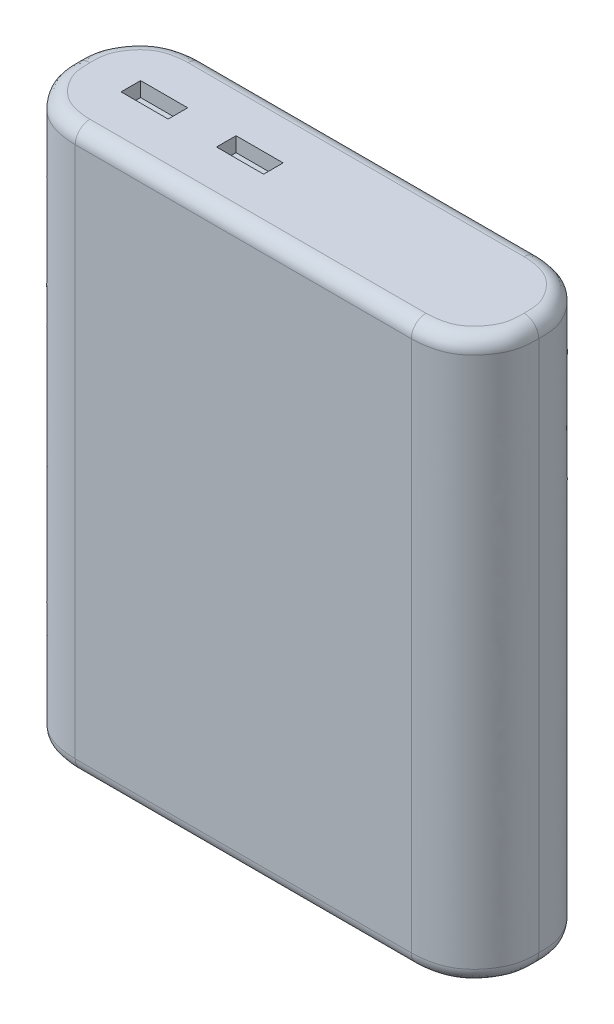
SolidWorks part; units mm, degrees
ref_plane "Front Plane" through (0, 0, 0) normal (0, 0, 1) x (1, 0, 0)
ref_plane "Top Plane" through (0, 0, 0) normal (0, 1, 0) x (1, 0, 0)
ref_plane "Right Plane" through (0, 0, 0) normal (1, 0, 0) x (0, 0, -1)
sketch "Sketch1" plane through (0, 0, 0) normal (0, 1, 0) x (1, 0, 0)
  line L0 (-29.0322, 0) -> (29.0322, 0)
  line L1 (29.0322, 0) -> (29.0322, -11.0109) construction
  line L2 (29.0322, -11.0109) -> (40.0431, -11.0109) construction
  line L3 (34.2155, -1.038) -> (34.2155, 0) construction
  line L4 (34.2155, 0) -> (29.0322, 0) construction
  line L5 (39.0051, -5.8276) -> (40.0431, -5.8276) construction
  line L6 (40.0431, -5.8276) -> (40.0431, -11.0109) construction
  line L7 (0, 0) -> (0, -10.5453) construction
  line L8 (-29.0322, -22.0218) -> (29.0322, -22.0218)
  spline S0 degree 3 poles (29.0322, 0) (30.334, 0) (35.1969, -0.5296) (39.334, -5.5865) (40.0431, -8.4922) (40.0431, -11.0109) knots 0 0 0 0 0.304751 0.695249 1 1 1 1
  spline S1 degree 3 poles (29.0322, -22.0218) (30.334, -22.0218) (35.1969, -21.4922) (39.334, -16.4353) (40.0431, -13.5296) (40.0431, -11.0109) knots 0 0 0 0 0.304751 0.695249 1 1 1 1
  spline S2 degree 3 poles (-29.0322, -22.0218) (-30.334, -22.0218) (-35.1969, -21.4922) (-39.334, -16.4353) (-40.0431, -13.5296) (-40.0431, -11.0109) knots 0 0 0 0 0.304751 0.695249 1 1 1 1
  spline S3 degree 3 poles (-29.0322, 0) (-30.334, 0) (-35.1969, -0.5296) (-39.334, -5.5865) (-40.0431, -8.4922) (-40.0431, -11.0109) knots 0 0 0 0 0.304751 0.695249 1 1 1 1
  point P17 (0, -22.0218)
  dimension "D1" = 80.0862
  dimension "D2" = 22.0218
extrude "Boss-Extrude1" add sketch "Sketch1" along normal blind 96.9772
fillet "Fillet1" radius 2.54 12 edges at (0, 0, 22.0218) (0, 96.9772, 22.0218) (0, 96.9772, 0) (0, 0, 0)
sketch "Sketch2" plane through (0, 96.9772, 0) normal (0, 1, 0) x (1, 0, 0)
  line L0 (-37.5031, -11.0109) -> (-40.0431, -11.0109) construction
  line L1 (-30.4385, -12.6989) -> (-22.3031, -12.6989)
  line L2 (-30.4385, -12.6989) -> (-30.4385, -9.3229)
  line L3 (-30.4385, -9.3229) -> (-22.3031, -9.3229)
  line L4 (-22.3031, -12.6989) -> (-22.3031, -9.3229)
  line L5 (-13.9464, -12.6989) -> (-5.811, -12.6989)
  line L6 (-13.9464, -12.6989) -> (-13.9464, -9.3229)
  line L7 (-13.9464, -9.3229) -> (-5.811, -9.3229)
  line L8 (-5.811, -12.6989) -> (-5.811, -9.3229)
  point P8 (-30.4385, -11.0109)
extrude "Cut-Extrude1" cut sketch "Sketch2" against normal blind 2.54
sketch "Sketch3" plane through (0, 0, 0) normal (0, 0, -1) x (-1, 0, 0)
  line L0 (-22.3012, 82.2579) -> (-22.3012, 78.9136) construction
  line L1 (-22.3012, 78.9136) -> (-22.3012, 75.5692) construction
  line L2 (-22.3012, 75.5692) -> (-22.3012, 72.2249) construction
  line L3 (-29.0322, 96.9772) -> (29.0322, 96.9772) construction
  line L4 (-40.0431, 94.4372) -> (-40.0431, 2.54) construction
  circle A0 centre (-22.3012, 82.2579) radius 0.4191
  circle A1 centre (-22.3012, 78.9136) radius 0.4191
  circle A2 centre (-22.3012, 75.5692) radius 0.4191
  circle A3 centre (-22.3012, 72.2249) radius 0.4191
  point P8 (-22.3012, 82.677)
  point P11 (-22.7203, 82.2579)
  dimension "D2" = 0.8382
  dimension "D1" = 10.033
  dimension "D3" = 14.3002
  dimension "D4" = 17.3228
extrude "Cut-Extrude2" cut sketch "Sketch3" against normal blind 2.54
ref_plane "Plane1" through (0, 48.4886, 0) normal (0, -1, 0) x (-1, 0, 0)
ref_plane "Plane2" through (40.0431, 0, 0) normal (1, 0, 0) x (0, 0, -1)
ref_plane "Plane3" through (-40.0431, 0, 0) normal (1, 0, 0) x (0, 0, -1)
ref_plane "Plane4" through (0, 0, 0) normal (1, 0, 0) x (0, 0, -1)
